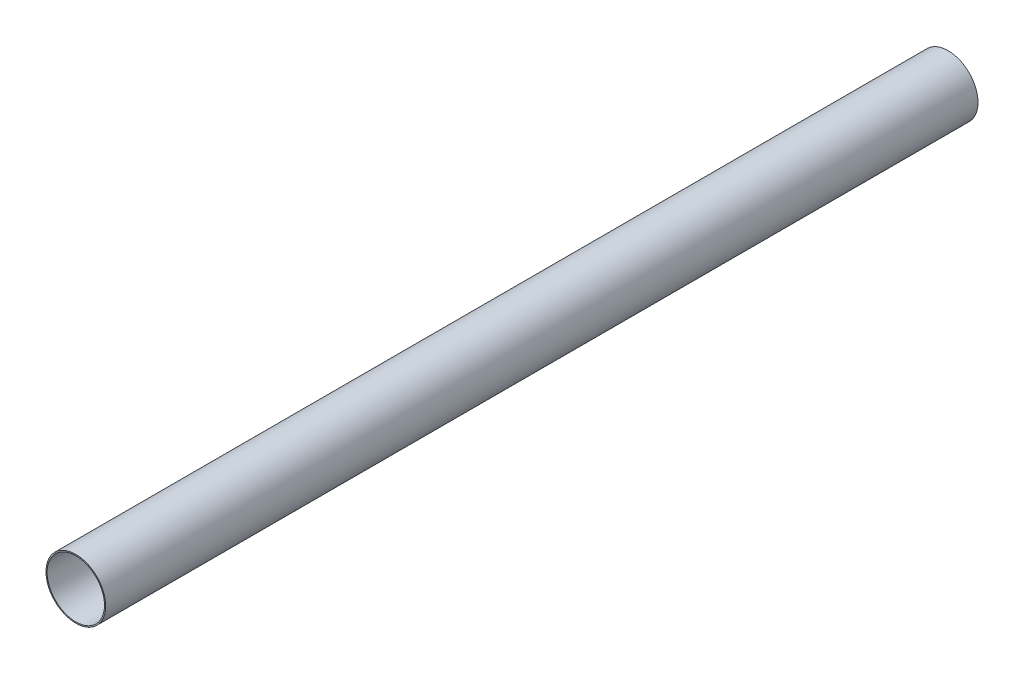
SolidWorks part; units mm, degrees
ref_plane "Plano frontal" through (0, 0, 0) normal (0, 0, 1) x (1, 0, 0)
ref_plane "Plano superior" through (0, 0, 0) normal (0, 1, 0) x (1, 0, 0)
ref_plane "Plano direito" through (0, 0, 0) normal (1, 0, 0) x (0, 0, -1)
sketch "Esboço1" plane through (0, 0, 0) normal (0, 0, 1) x (1, 0, 0)
  circle A0 centre (0, 0) radius 26
  circle A1 centre (0, 0) radius 25
surface "Superfície-Extrusão1" sketch "Esboço1" parameters "D1"=380, "D2"=380
